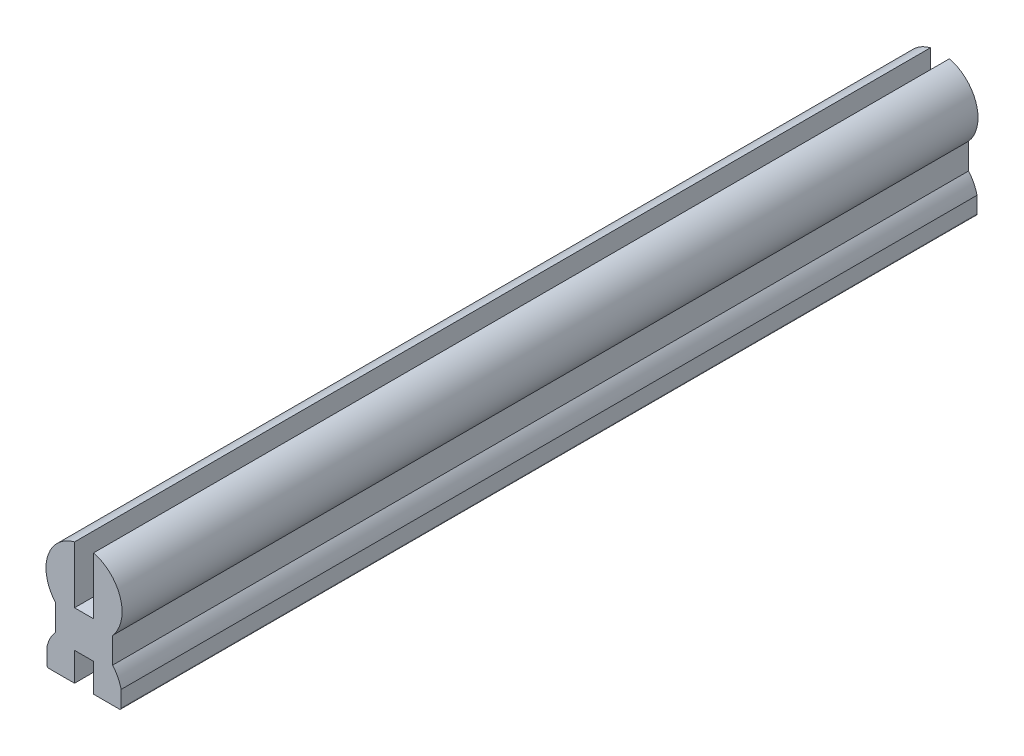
SolidWorks part; units mm, degrees
ref_plane "前视基准面" through (0, 0, 0) normal (0, 0, 1) x (1, 0, 0)
ref_plane "上视基准面" through (0, 0, 0) normal (0, 1, 0) x (1, 0, 0)
ref_plane "右视基准面" through (0, 0, 0) normal (1, 0, 0) x (0, 0, -1)
sketch "草图1" plane through (0, 0, 0) normal (0, 0, 1) x (1, 0, 0)
  line L0 (-1.95, -2.5) -> (-0.5, -2.5)
  line L1 (-0.5, 3.9365) -> (-0.5, 0.9365)
  line L2 (-1.5, 0.6771) -> (-1.5, -0.6771)
  line L3 (0.5, 0.9365) -> (0.5, 3.9365)
  line L4 (1.5, 0.6771) -> (1.5, -0.6771)
  line L5 (-1.95, -2.5) -> (-1.95, -1.5556)
  line L6 (1.95, -2.5) -> (1.95, -1.5556)
  line L7 (-0.5, -1) -> (0.5, -1)
  line L9 (-0.5, -1) -> (-0.5, -2.5)
  line L10 (0.5, -1) -> (0.5, -2.5)
  line L11 (0.5, -2.5) -> (1.95, -2.5)
  line L13 (-0.5, 0.9365) -> (0.5, 0.9365)
  arc A0 (1.95, -1.5556) -> (1.5, -0.6771) centre (0, -2) ccw
  arc A1 (-1.5, -0.6771) -> (-1.95, -1.5556) centre (0, -2) ccw
  arc A2 (1.5, 0.6771) -> (0.5, 3.9365) centre (0, 2) ccw
  arc A3 (-0.5, 3.9365) -> (-1.5, 0.6771) centre (0, 2) ccw
extrude "凸台-拉伸1" add sketch "草图1" against normal blind 45
fillet "圆角1" radius 0.1 2 edges at (-1.95, -2.5, -22.5) (1.95, -2.5, -22.5)
